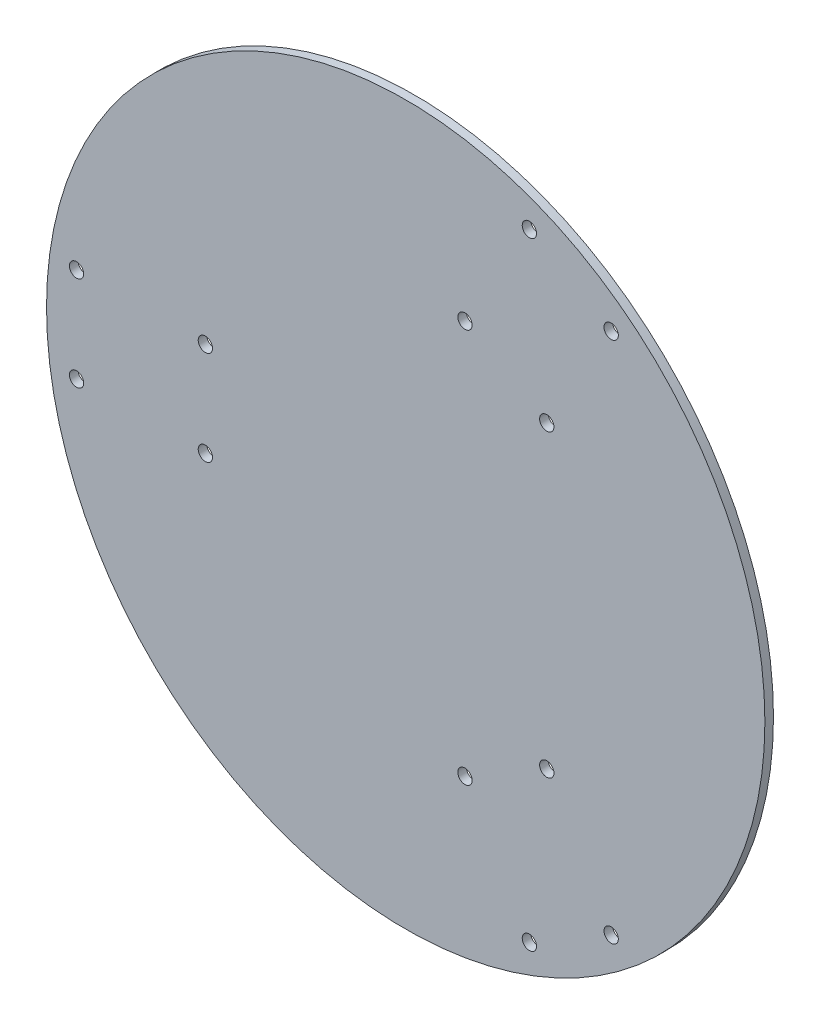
SolidWorks part; units mm, degrees
ref_plane "Přední" through (0, 0, 0) normal (0, 0, 1) x (1, 0, 0)
ref_plane "Horní" through (0, 0, 0) normal (0, 1, 0) x (1, 0, 0)
ref_plane "Pravá" through (0, 0, 0) normal (1, 0, 0) x (0, 0, -1)
sketch "Skica1" plane through (0, 0, 0) normal (0, 0, 1) x (1, 0, 0)
  circle A0 centre (0, 0) radius 125.5
  dimension "D1" = 251
sheet metal parameters "Plechový díl1" thickness 3 parameters "D1"=3
base flange "Základní plech1" sketch "Skica1" thickness 3 reverse thickness direction yes parameters "D1"=3
hole_wizard "M5.0 (5.000000) průměrové díry1" positions "Skica4" profile "Skica3" hole size "M5.0" standard "ISO"
sketch "Skica4" plane through (0, 0, 0) normal (0, 0, -1) x (-1, 0, 0)
  point P1 (115, -16.5)
  point P4 (115, 16.5)
  point P7 (70, 16.5)
  point P10 (70, -16.5)
  dimension "D1" = 33
  dimension "D2" = 45
  dimension "D3" = 16.5
  dimension "D4" = 70
sketch "Skica3" plane through (-115, -16.5, 0) normal (1, 0, 0) x (0, 1, 0)
  line L0 (0, 0) -> (0, 16.5022)
  line L1 (0, 16.5022) -> (2.5, 15)
  line L2 (2.5, 15) -> (2.5, 0)
  line L5 (2.5, 0) -> (0, 0)
  line L10 (0, 16.5022) -> (-2.5, 15) construction
  line L11 (0, -6.35) -> (0, 107.95) construction
  dimension "Prùmìr díry" = 5
  dimension "Hloubka díry" = 15
  dimension "Úhel vrtání" = 118
pattern_circular "Kruhové pole1" count 3 over 360 about axis through (0, 0, 0) along (0, 0, 1) of "M5.0 (5.000000) průměrové díry1"
flat pattern "Rozvinutý tvar1"
sketch "Čáry ohybu1" plane through (0, 0, 0) normal (0, 1, 0) x (-1, 0, 0)
sketch3d "Bounding-Box1" [suppressed]
  line L0 (125.3749, 125.6249, 0) -> (125.6249, -125.3749, 0) construction
  line L1 (-125.6249, 125.3749, 0) -> (-125.3749, -125.6249, 0) construction
  line L2 (125.3749, 125.6249, 0) -> (-125.6249, 125.3749, 0) construction
  line L3 (125.6249, -125.3749, 0) -> (-125.3749, -125.6249, 0) construction
